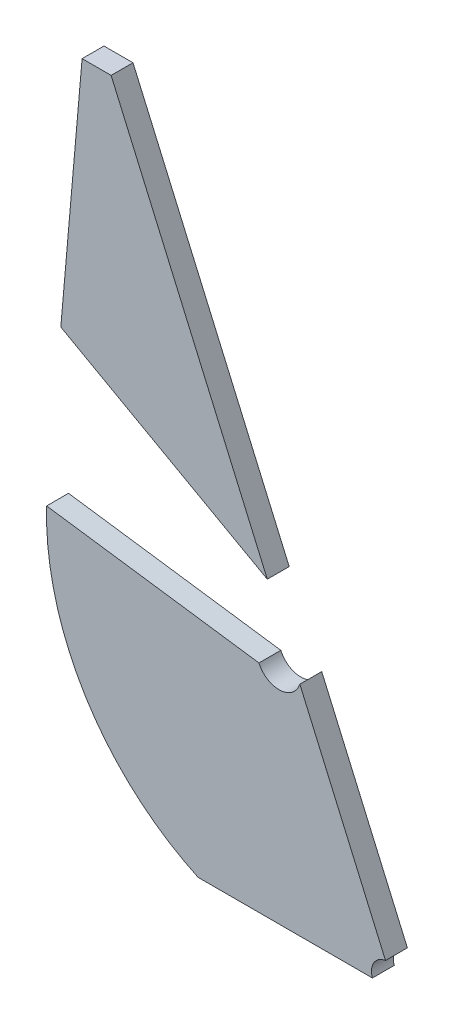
SolidWorks part; units mm, degrees
ref_plane "Front Plane" through (0, 0, 0) normal (0, 0, 1) x (1, 0, 0)
ref_plane "Top Plane" through (0, 0, 0) normal (0, 1, 0) x (1, 0, 0)
ref_plane "Right Plane" through (0, 0, 0) normal (1, 0, 0) x (0, 0, -1)
sketch "Sketch1" plane through (0, 0, 0) normal (0, 0, 1) x (1, 0, 0)
  line L0 (35.4645, 189.852) -> (241.0949, -281.7939)
  line L1 (338.7512, -565.806) -> (136.4199, -565.806)
  line L3 (364.7551, -549.5394) -> (115.0361, 23.2306) construction
  line L4 (1.7846, 189.852) -> (-39.3884, -280.348)
  line L5 (254.5236, -312.5949) -> (353.9345, -540.6095)
  line L6 (1.7846, 189.852) -> (35.4645, 189.852)
  arc A0 (-39.3884, -280.348) -> (136.4199, -565.806) centre (265.2717, -289.581) ccw
  arc A1 (241.0949, -281.7939) -> (254.5236, -312.5949) centre (230.3467, -304.8078) ccw
  arc A2 (353.9345, -540.6095) -> (338.7512, -565.806) centre (356.7117, -559.456) ccw
  dimension "D1" = 609.6
  dimension "D2" = 50.8
  dimension "D3" = 38.1
  dimension "D4" = 6.35
  dimension "D5" = 6.35
extrude "Boss-Extrude1" add sketch "Sketch1" along normal blind 25.4
sketch "Sketch2" plane through (0, 0, 25.4) normal (0, 0, 1) x (1, 0, 0)
  line L0 (-22.927, -92.3571) -> (216.7545, -225.9655)
  line L1 (1.7846, 189.852) -> (-39.3884, -280.348) construction
  line L2 (-22.927, -92.3571) -> (-39.3884, -280.348)
  line L3 (-39.3884, -280.348) -> (207.0634, -314.9589)
  line L4 (241.0949, -281.7939) -> (35.4645, 189.852) construction
  line L5 (216.7545, -225.9655) -> (241.0949, -281.7939)
  arc A0 (241.0949, -281.7939) -> (207.0634, -314.9589) centre (230.3467, -304.8078) ccw
  arc A1 (241.0949, -281.7939) -> (254.5236, -312.5949) centre (230.3467, -304.8078) ccw construction
extrude "Cut-Extrude1" cut sketch "Sketch2" against normal through all
